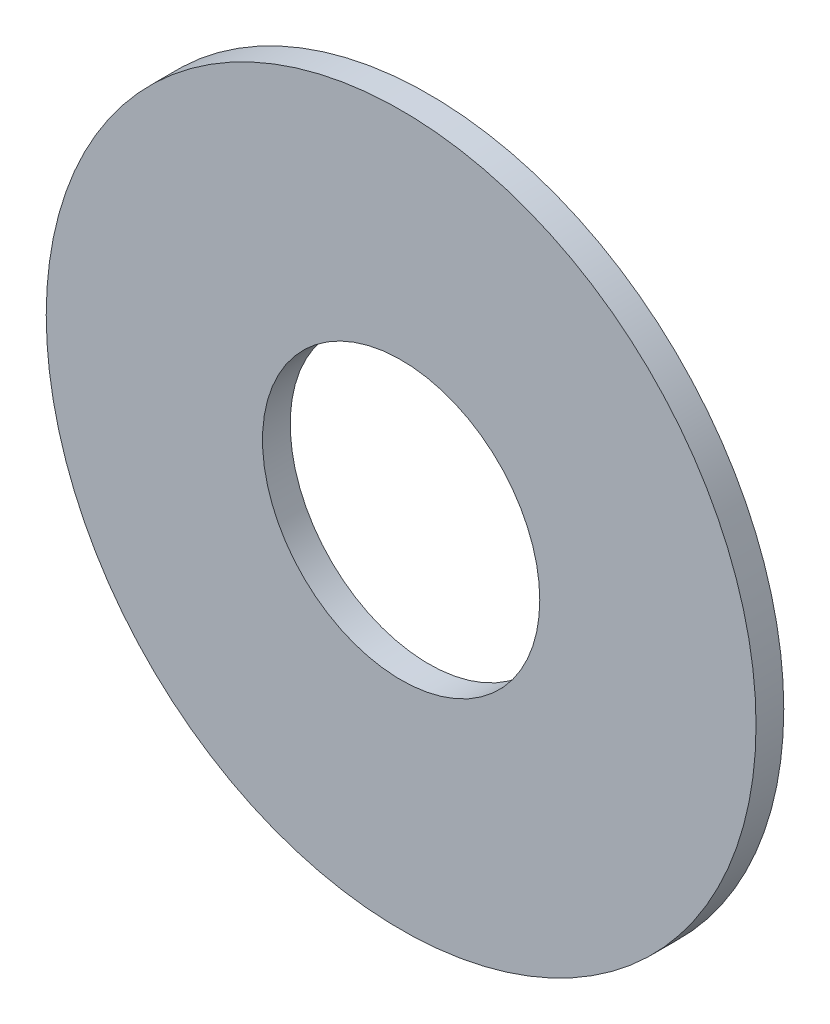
SolidWorks part; units mm, degrees
ref_plane "Plan de face" through (0, 0, 0) normal (0, 0, 1) x (1, 0, 0)
ref_plane "Plan de dessus" through (0, 0, 0) normal (0, 1, 0) x (1, 0, 0)
ref_plane "Plan de droite" through (0, 0, 0) normal (1, 0, 0) x (0, 0, -1)
sketch "Esquisse1" plane through (0, 0, 0) normal (0, 0, 1) x (1, 0, 0)
  circle A0 centre (0, 0) radius 64
  circle A1 centre (0, 0) radius 25
  dimension "D1" = 128
  dimension "D2" = 50
extrude "Extrusion1" add sketch "Esquisse1" along normal blind 5
